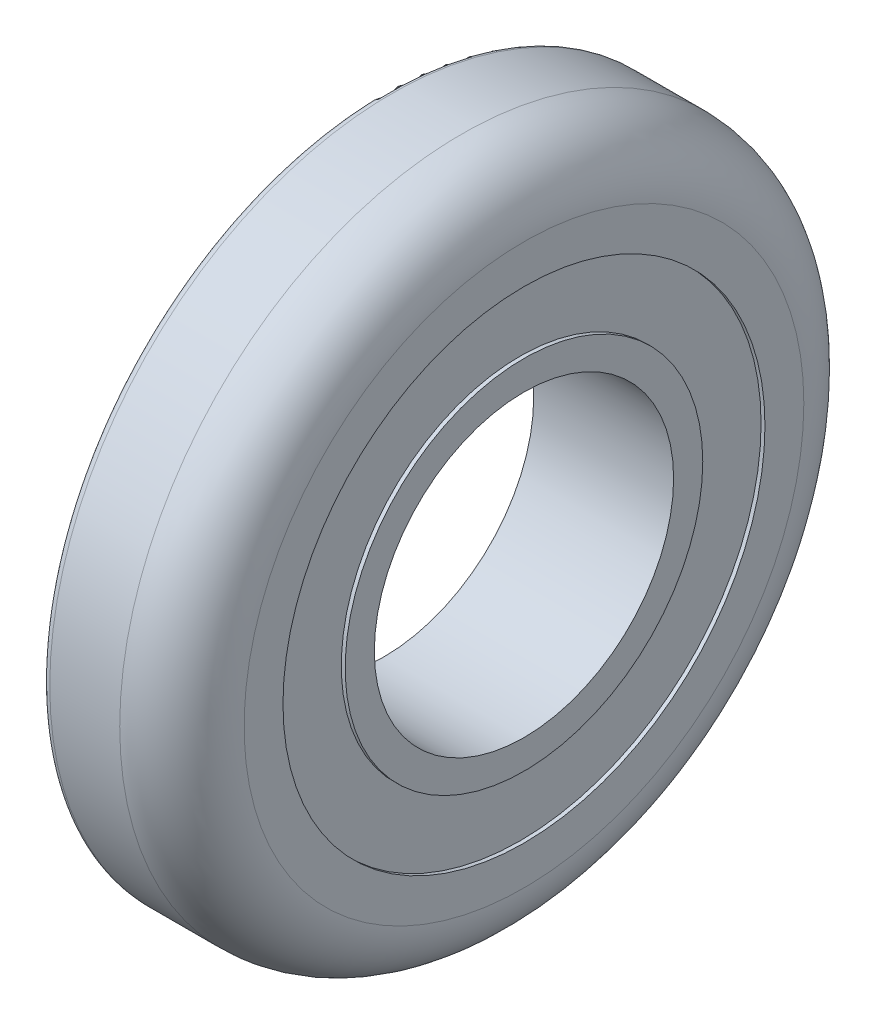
SolidWorks part; units mm, degrees
ref_plane "Front Plane" through (0, 0, 0) normal (0, 0, 1) x (1, 0, 0)
ref_plane "Top Plane" through (0, 0, 0) normal (0, 1, 0) x (1, 0, 0)
ref_plane "Right Plane" through (0, 0, 0) normal (1, 0, 0) x (0, 0, -1)
sketch "Sketch1" plane through (0, 0, 0) normal (1, 0, 0) x (0, 0, -1)
  circle A0 centre (0, 0) radius 19.25
  circle A1 centre (0, 0) radius 44
  dimension "D1" = 88
  dimension "D2" = 38.5
extrude "Boss-Extrude1" add sketch "Sketch1" along normal blind 18
fillet "Fillet1" radius 8 1 edges at (18, 0, -44)
fillet "Fillet2" radius 1 1 edges at (0, 0, -44)
sketch "Sketch2" plane through (18, 0, 0) normal (1, 0, 0) x (0, 0, -1)
  circle A0 centre (0, 0) radius 23
  circle A1 centre (0, 0) radius 31
  dimension "D1" = 46
  dimension "D2" = 62
extrude "Cut-Extrude1" cut sketch "Sketch2" against normal blind 0.5
sketch "Sketch3" plane through (0, 0, 0) normal (-1, 0, 0) x (0, 0, 1)
  circle A1 centre (0, 0) radius 31
  circle A2 centre (0, 0) radius 31
  circle A3 centre (0, 0) radius 23
  circle A4 centre (0, 0) radius 23
  dimension "D1" = 0
  dimension "D2" = 0
extrude "Cut-Extrude2" cut sketch "Sketch3" against normal blind 0.5
